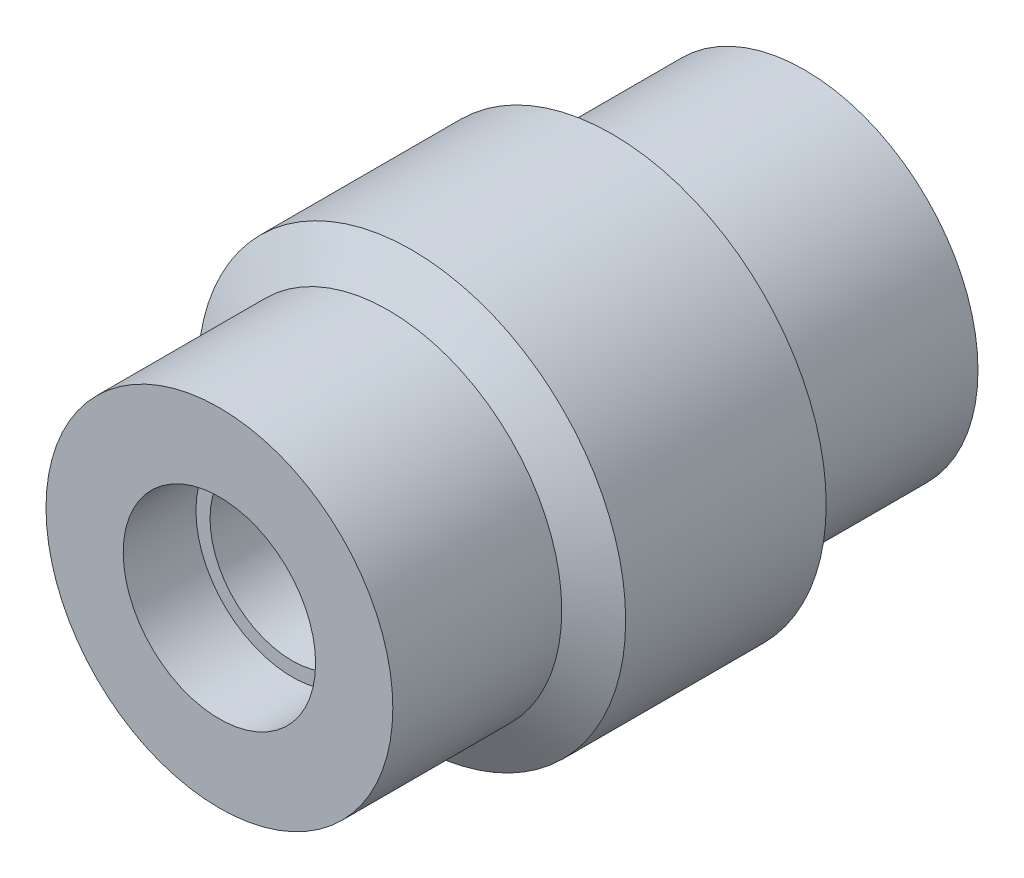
SolidWorks part; units mm, degrees
ref_plane "Front Plane" through (0, 0, 0) normal (0, 0, 1) x (1, 0, 0)
ref_plane "Top Plane" through (0, 0, 0) normal (0, 1, 0) x (1, 0, 0)
ref_plane "Right Plane" through (0, 0, 0) normal (1, 0, 0) x (0, 0, -1)
sketch "Sketch1" plane through (0, 0, 0) normal (0, 0, 1) x (1, 0, 0)
  circle A0 centre (0, 0) radius 7.3914
  circle A1 centre (0, 0) radius 3.5
  dimension "D1" = 14.7828
  dimension "D2" = 7
extrude "Boss-Extrude1" add sketch "Sketch1" along normal blind 24.9428
sketch "Sketch2" plane through (0, 0, 0) normal (0, 1, 0) x (1, 0, 0)
  line L0 (-10.2172, -12.4714) -> (11.0099, -12.4714) construction
  line L1 (-7.3914, -7.2009) -> (-7.3914, -17.7419)
  line L2 (7.3914, 0) -> (-7.3914, 0) construction
  line L3 (-7.3914, -24.9428) -> (7.3914, -24.9428) construction
  line L4 (-7.3914, 0) -> (-7.3914, -24.9428) construction
  line L5 (-9.1186, -8.1981) -> (-9.1186, -16.7447)
  line L6 (-7.3914, -7.2009) -> (-9.1186, -8.1981)
  line L7 (-7.3914, -17.7419) -> (-9.1186, -16.7447)
  line L8 (0, 0) -> (0, -24.9428) construction
  dimension "D1" = 1.7272
  dimension "D2" = 60
  dimension "D3" = 10.541
revolve "Revolve1" add sketch "Sketch2" angle 360 about L8
sketch "Sketch3" plane through (0, 0, 24.9428) normal (0, 0, 1) x (1, 0, 0)
  circle A0 centre (0, 0) radius 4.1
  dimension "D1" = 8.2
extrude "Cut-Extrude1" cut sketch "Sketch3" against normal blind 3.1
ref_plane "Plane1" through (0, 0, 12.4714) normal (0, 0, 1) x (1, 0, 0)
mirror "Mirror1" about plane through (0, 0, 12.4714) normal (0, 0, 1) of "Cut-Extrude1"
